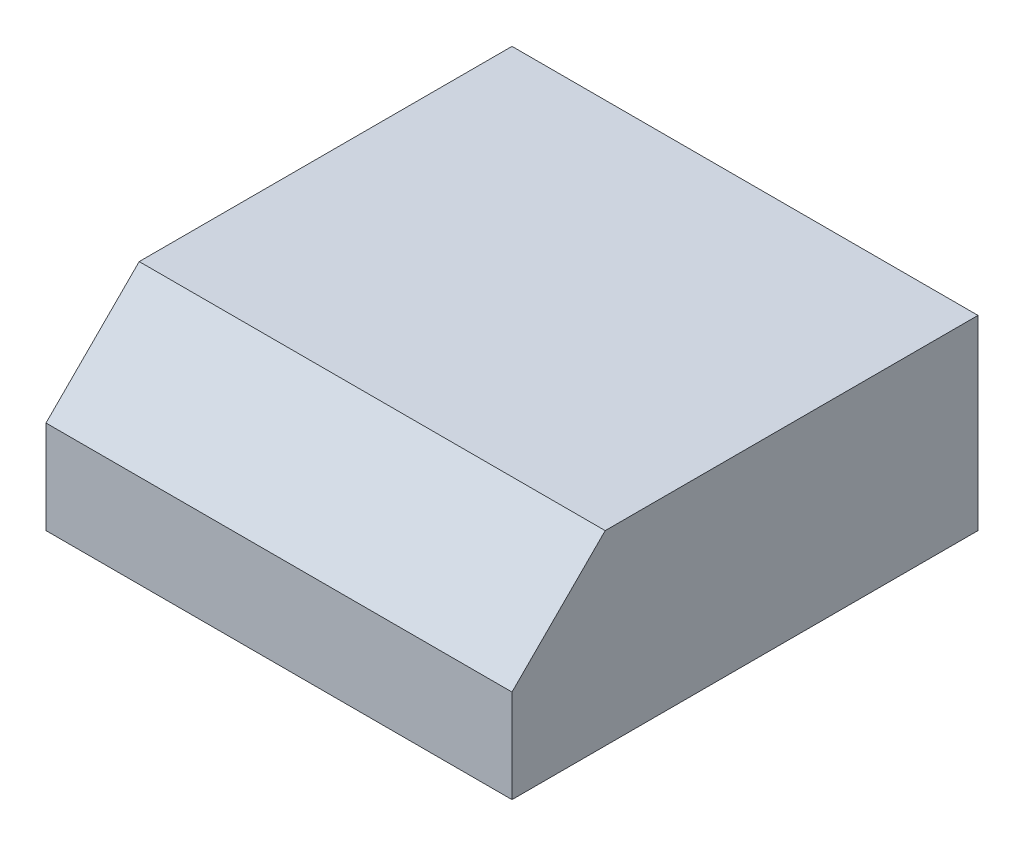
SolidWorks part; units mm, degrees
ref_plane "Front" through (0, 0, 0) normal (0, 0, 1) x (1, 0, 0)
ref_plane "Top" through (0, 0, 0) normal (0, 1, 0) x (1, 0, 0)
ref_plane "Right" through (0, 0, 0) normal (1, 0, 0) x (0, 0, -1)
sketch "Sketch2" plane through (0, 0, 0) normal (0, 1, 0) x (1, 0, 0)
  line L0 (25, -25) -> (-25, 25) construction
  line L1 (-25, 25) -> (25, 25)
  line L2 (-25, 25) -> (-25, -25)
  line L3 (-25, -25) -> (25, -25)
  line L4 (25, 25) -> (25, -25)
  dimension "D1" = 50
  dimension "D2" = 50
extrude "Extrude1" add sketch "Sketch2" along normal blind 20
sketch "Sketch4" plane through (0, 20, 0) normal (0, 1, 0) x (-1, 0, 0)
  line L0 (-25, 25) -> (-25, -25) construction
  line L1 (25, -25) -> (25, 25) construction
  circle A0 centre (-17.5, 18.7198) radius 3.0799
  circle A1 centre (0, 18.7198) radius 3.0799
  circle A2 centre (17.5, 18.7198) radius 3.0799
  dimension "D1" = 7.5
  dimension "D2" = 7.5
extrude "Extrude3" add sketch "Sketch4" along normal blind 10
chamfer "Chamfer1" distance 10 angle 45 1 edges at (0, 20, 25)
